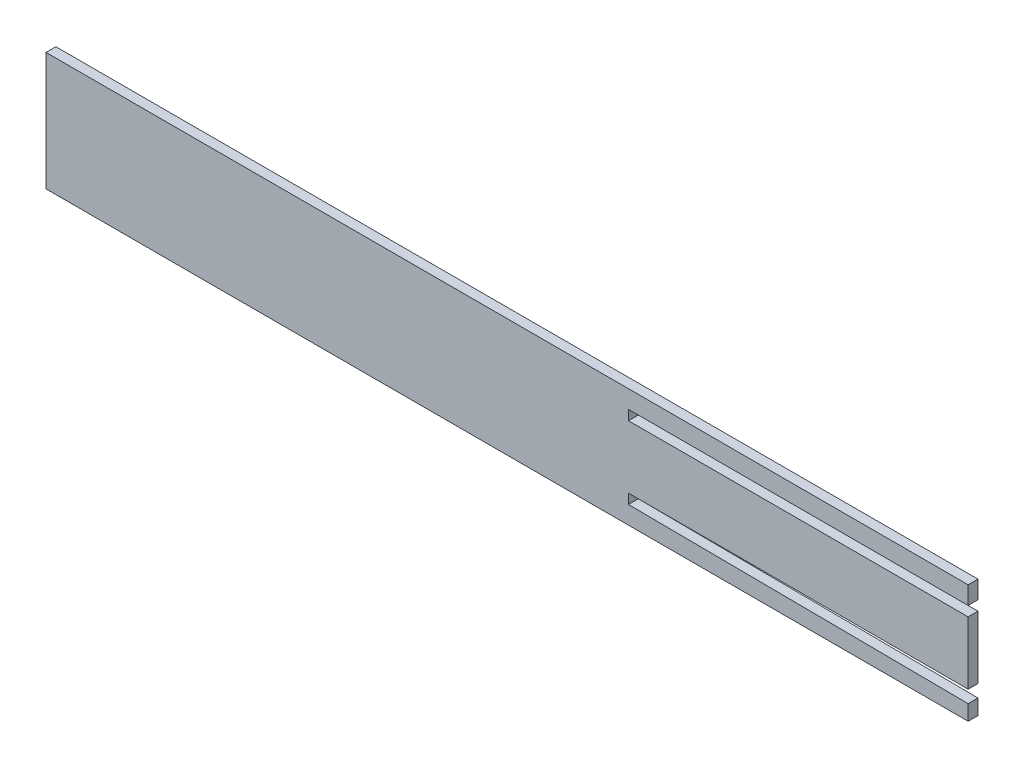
SolidWorks part; units mm, degrees
ref_plane "Front Plane" through (0, 0, 0) normal (0, 0, 1) x (1, 0, 0)
ref_plane "Top Plane" through (0, 0, 0) normal (0, 1, 0) x (1, 0, 0)
ref_plane "Right Plane" through (0, 0, 0) normal (1, 0, 0) x (0, 0, -1)
sketch "Sketch1" plane through (0, 0, 0) normal (0, 0, 1) x (1, 0, 0)
  line L0 (0, 33) -> (514.83, 33) construction
  line L1 (0, 0) -> (514.83, 0)
  line L2 (0, 0) -> (0, 66)
  line L3 (0, 66) -> (514.83, 66)
  line L5 (0, 33) -> (325.19, 33) construction
  line L6 (514.83, 33) -> (514.83, 15.5)
  line L7 (325.19, 50.5) -> (514.83, 50.5)
  line L9 (514.83, 56) -> (325.19, 56)
  line L10 (325.19, 56) -> (325.19, 50.5)
  line L11 (514.83, 56) -> (514.83, 66)
  line L12 (514.83, 50.5) -> (514.83, 33)
  line L13 (514.83, 15.5) -> (325.19, 15.5)
  line L14 (325.19, 15.5) -> (325.19, 10)
  line L15 (325.19, 10) -> (514.83, 8.5201)
  line L16 (514.83, 8.5201) -> (514.83, 0)
  dimension "D1" = 66
  dimension "D2" = 514.83
extrude "Boss-Extrude1" add sketch "Sketch1" along normal blind 5.5
